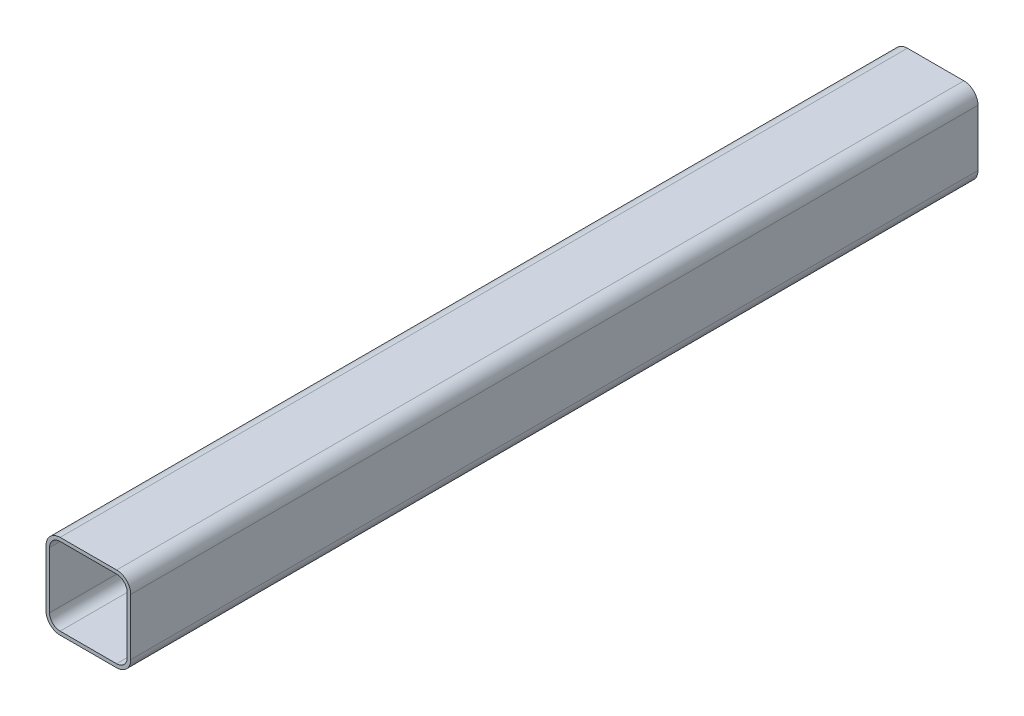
SolidWorks part; units mm, degrees
ref_plane "Front" through (0, 0, 0) normal (0, 0, 1) x (1, 0, 0)
ref_plane "Top" through (0, 0, 0) normal (0, 1, 0) x (1, 0, 0)
ref_plane "Right" through (0, 0, 0) normal (1, 0, 0) x (0, 0, -1)
sketch "Sketch1" plane through (0, 0, 0) normal (0, 0, 1) x (1, 0, 0)
  line L0 (-25.4, 38.1) -> (25.4, 38.1)
  line L1 (-38.1, 25.4) -> (-38.1, -25.4)
  line L2 (25.4, -38.1) -> (-25.4, -38.1)
  line L3 (38.1, -25.4) -> (38.1, 25.4)
  line L4 (0, 38.1) -> (0, -38.1) construction
  arc A0 (38.1, 25.4) -> (25.4, 38.1) centre (25.4, 25.4) ccw
  arc A1 (38.1, -25.4) -> (25.4, -38.1) centre (25.4, -25.4) cw
  arc A2 (-25.4, -38.1) -> (-38.1, -25.4) centre (-25.4, -25.4) cw
  arc A3 (-38.1, 25.4) -> (-25.4, 38.1) centre (-25.4, 25.4) cw
  dimension "D1" = 12.7
  dimension "D2" = 76.2
  dimension "D3" = 76.2
extrude "Base-Extrude-Thin" add sketch "Sketch1" along normal blind 762 thin
